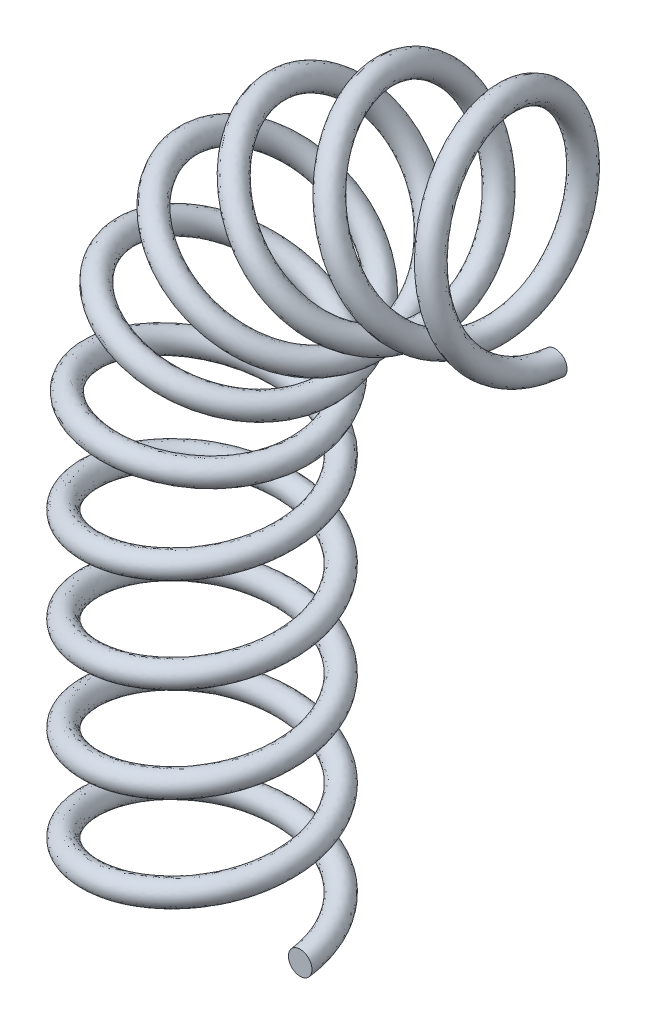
SolidWorks part; units mm, degrees
ref_plane "Front Plane" through (0, 0, 0) normal (0, 0, 1) x (1, 0, 0)
ref_plane "Top Plane" through (0, 0, 0) normal (0, 1, 0) x (1, 0, 0)
ref_plane "Right Plane" through (0, 0, 0) normal (1, 0, 0) x (0, 0, -1)
sketch "Sketch1" plane through (0, 0, 0) normal (0, 0, 1) x (1, 0, 0)
  line L0 (0, 0) -> (0, 50)
  arc A0 (0, 50) -> (45, 95) centre (45, 50) cw
sketch "Sketch2" plane through (0, 0, 0) normal (0, 0, 1) x (1, 0, 0)
  line L0 (0, 0) -> (0, 50) construction
  circle A0 centre (12.5, 0) radius 1.5
sweep "Sweep1" add profiles "Sketch2" path "Sketch1" parameters "D4"=3600
equation "\"A\"= 45"
equation "\"B\"= 45"
equation "\"C\"= 50"
equation "\"D\"= 3"
equation "\"E\"= 25"
equation "\"D1@Sketch1\"=\"C\""
equation "\"D2@Sketch1\"=\"B\""
equation "\"D3@Sketch1\"=\"A\""
equation "\"D1@Sketch2\"=\"D\""
equation "\"D2@Sketch2\"= \"E\"/2"
